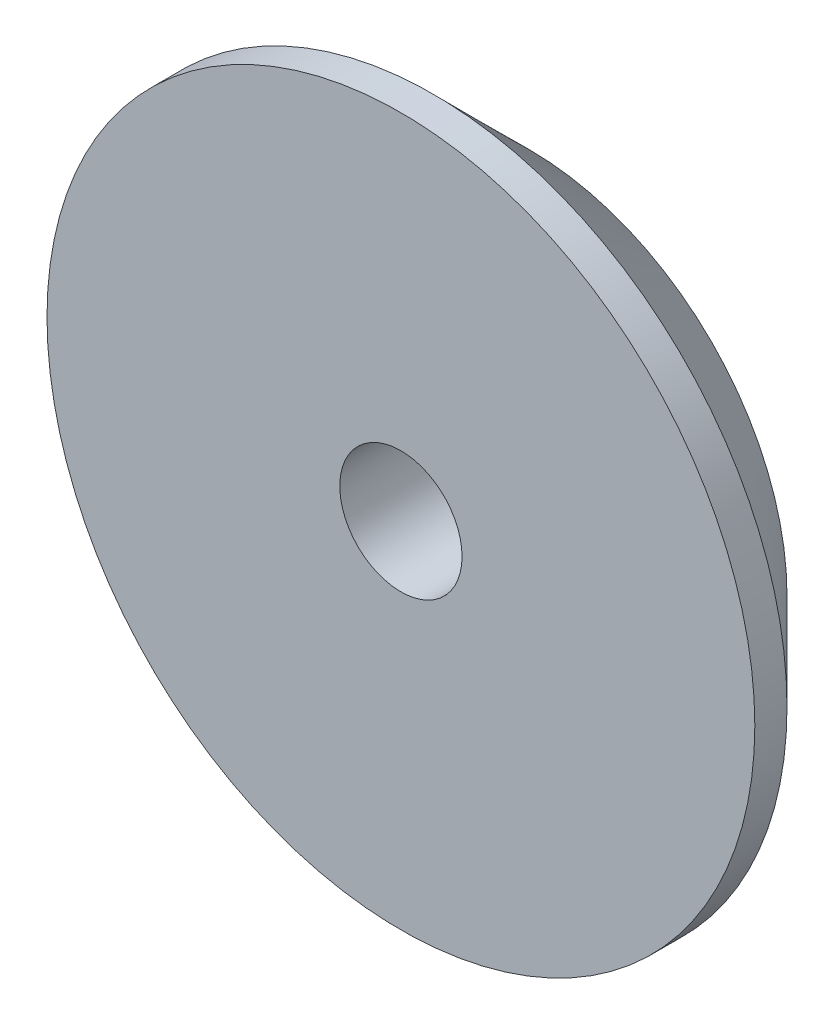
SolidWorks part; units mm, degrees
ref_plane "Plan de face" through (0, 0, 0) normal (0, 0, 1) x (1, 0, 0)
ref_plane "Plan de dessus" through (0, 0, 0) normal (0, 1, 0) x (1, 0, 0)
ref_plane "Plan de droite" through (0, 0, 0) normal (1, 0, 0) x (0, 0, -1)
sketch "Esquisse1" plane through (0, 0, 0) normal (0, 0, 1) x (1, 0, 0)
  circle A0 centre (0, 0) radius 0.95
  circle A1 centre (0, 0) radius 5.5
extrude "Extrusion1" add sketch "Esquisse1" along normal blind 2
chamfer "Chanfrein1" distance 1.5 distance2 1.5 1 edges at (5.5, 0, 0)
